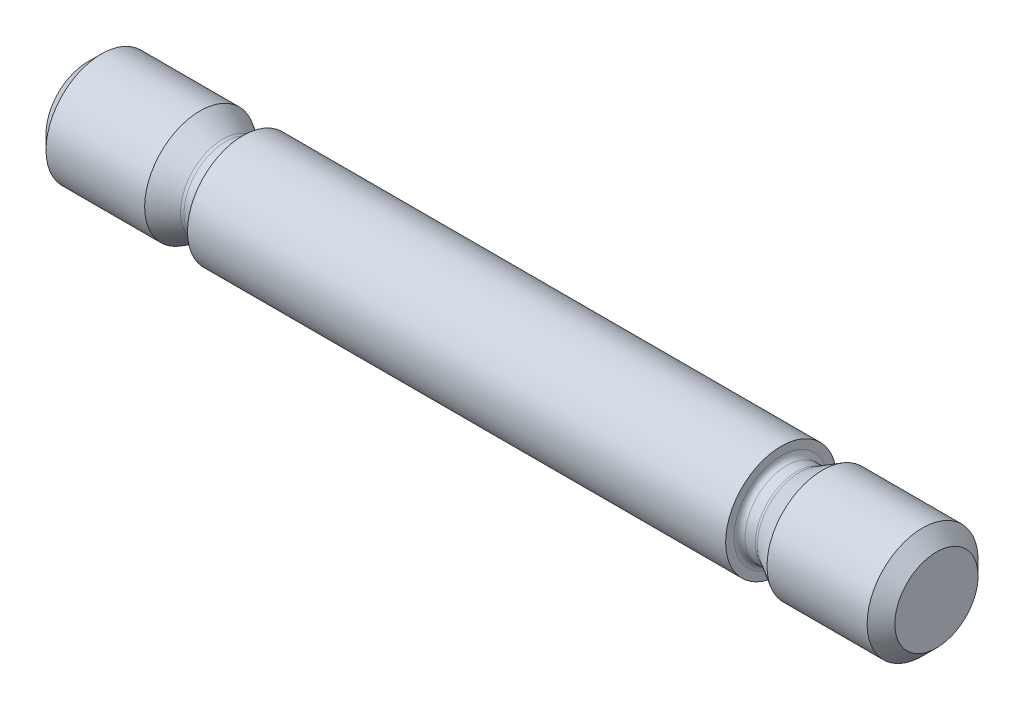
SolidWorks part; units mm, degrees
revolve "BaseBody" add sketch "BodySke" angle 360 about L14
sketch "BodySke" plane through (0, 0, 0) normal (0, 0, 1) x (1, 0, 0)
  line L0 (19.5, 6.1072) -> (16.2215, 8)
  line L1 (16.2215, 8) -> (2, 8)
  line L2 (22.4, 8) -> (22.4, 6.8)
  line L3 (21.6, 6) -> (19.9, 6)
  line L5 (2, 8) -> (0, 6)
  line L7 (100, 8) -> (100, 6.8)
  line L8 (100.8, 6) -> (102.2856, 6)
  line L9 (102.6856, 6.1072) -> (105.9641, 8)
  line L10 (105.9641, 8) -> (120.4, 8)
  line L11 (120.4, 8) -> (122.4, 6)
  line L12 (122.4, 6) -> (122.4, 0)
  line L13 (122.4, 0) -> (0, 0)
  line L14 (-3.175, 0) -> (101.6, 0) construction
  line L15 (108.7794, -6) -> (122.4, -6) construction
  line L16 (100, -6) -> (102.5, -6) construction
  line L17 (37.0699, -8) -> (100, -8) construction
  line L18 (0, 6) -> (0, 0)
  line L19 (22.4, 8) -> (100, 8)
  line L20 (104.5, 10.8514) -> (104.5, -6.5014) construction
  line L21 (100, 10.2761) -> (100, -5.5735) construction
  arc A0 (19.9, 6) -> (19.5, 6.1072) centre (19.9, 6.8) cw
  arc A1 (22.4, 6.8) -> (21.6, 6) centre (21.6, 6.8) cw
  arc A2 (102.2856, 6) -> (102.6856, 6.1072) centre (102.2856, 6.8) ccw
  arc A3 (100, 6.8) -> (100.8, 6) centre (100.8, 6.8) ccw
  point P26 (102.5, 6)
  point P29 (100, 6)
ref_plane "Plane1" through (0, 0, 0) normal (0, 0, 1) x (1, 0, 0)
ref_plane "Plane2" through (0, 0, 0) normal (0, 1, 0) x (1, 0, 0)
ref_plane "Plane3" through (0, 0, 0) normal (1, 0, 0) x (0, 0, -1)
sketch "ThdSchSke" plane through (0, 0, 0) normal (0, 0, 1) x (1, 0, 0)
  line L0 (104.5, -6) -> (103.0996, -8)
  line L1 (104.5, -6) -> (105.9004, -8)
  line L2 (105.9004, -8) -> (105.9004, -10)
  line L3 (-3.175, 0) -> (5.1513, 0) construction
  line L5 (105.9004, -10) -> (103.0996, -10)
  line L6 (103.0996, -10) -> (103.0996, -8)
  line L7 (122.4, -6) -> (122.4, 6) construction
revolve "ThreadSchematic" [suppressed] cut sketch "ThdSchSke" angle 360 about L3
pattern_linear "ThdSchPat" [suppressed]
sketch "ThdSchSketStud" plane through (0, 0, 0) normal (0, 0, 1) x (1, 0, 0)
  line L0 (17.9, -6) -> (16.4996, -8)
  line L1 (17.9, -6) -> (19.3004, -8)
  line L2 (19.3004, -8) -> (19.3004, -10)
  line L3 (-3.175, 0) -> (5.1513, 0) construction
  line L5 (19.3004, -10) -> (16.4996, -10)
  line L6 (16.4996, -10) -> (16.4996, -8)
  line L7 (0, 6) -> (0, -6) construction
revolve "ThreadSchematicStud" [suppressed] cut sketch "ThdSchSketStud" angle 360 about L3
pattern_linear "ThdSchPatStud" [suppressed]
equation "\"Thread_len@BodySke\" = \"Thread_nom@BodySke\""
equation "\"Studend_length@BodySke\" = \"Thread_len@BodySke\""
equation "\"Thread_minor@ThreadCosmetic\" = \"Minor_dia@BodySke\""
equation "\"Thrd_Minor@ThreadCosmeticStud\" = \"Thread_minor@ThreadCosmetic\""
equation "\"Thread_minor@ThdSchSke\" = \"Minor_dia@BodySke\""
equation "\"Diameter@ThdSchSke\" = \"Thread_dia@BodySke\""
equation "\"Overcut@ThdSchSke\" = \"Thread_dia@BodySke\" * 1.25"
equation "\"Start@ThdSchSke\" = \"Thread_nom@BodySke\"  - \"Thread_neck_width@BodySke\" - \"Advance@BodySke\""
equation "\"Num_threads@ThdSchPat\" = int( \"Start@ThdSchSke\" / \"Advance@BodySke\" + 0.999 ) + 1"
equation "\"Advance@ThdSchPat\" = \"Start@ThdSchSke\" /  ( \"Num_threads@ThdSchPat\" - 1 ) 'relax it"
equation "'  \"Num_threads@ThdSchPat\" = \"Num_threads@ThdSchPat\" - sgn( \"Num_threads@ThdSchPat\" - 1 ) '---chamfered tips only---"
equation "\"Diameter@ThdSchSketStud\" = \"Diameter@ThdSchSke\""
equation "\"Thread_minor@ThdSchSketStud\" = \"Thread_minor@ThdSchSke\""
equation "\"Overcut@ThdSchSketStud\" = \"Overcut@ThdSchSke\""
equation "\"Start_@ThdSchSketStud\" = \"Studend_length@BodySke\" - \"Shoulder_neck_width@BodySke\" - \"Advance@BodySke\""
equation "\"Num_Threads@ThdSchPatStud\" = int ( \"Start_@ThdSchSketStud\" / \"Advance@BodySke\" + 0.999 )  + 1"
equation "\"Advance@ThdSchPatStud\" = \"Start_@ThdSchSketStud\" /  ( \"Num_Threads@ThdSchPatStud\" - 1 ) 'relax it"
